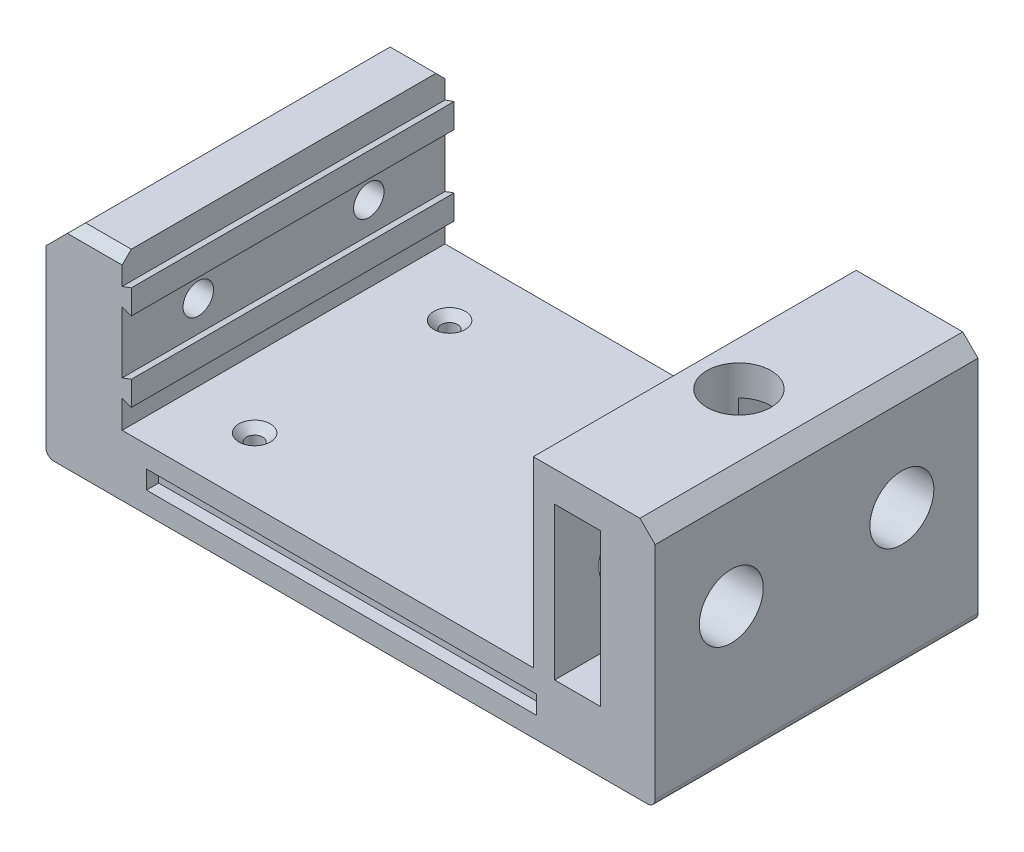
SolidWorks part; units mm, degrees
ref_plane "Спереди" through (0, 0, 0) normal (0, 0, 1) x (1, 0, 0)
ref_plane "Сверху" through (0, 0, 0) normal (0, 1, 0) x (1, 0, 0)
ref_plane "Справа" through (0, 0, 0) normal (1, 0, 0) x (0, 0, -1)
sketch "Эскиз1" plane through (0, 0, 0) normal (0, 0, 1) x (1, 0, 0)
  line L0 (-67.5, 0) -> (67.5, 0)
  line L1 (-67.5, 0) -> (-67.5, 50)
  line L2 (67.5, 0) -> (67.5, 60)
  line L3 (-67.5, 50) -> (-82.5, 50)
  line L4 (-82.5, 50) -> (-92.5, 40)
  line L5 (-92.5, 40) -> (-92.5, -20)
  line L6 (-92.5, -20) -> (107.5, -20)
  line L7 (0, 0) -> (0, 62.9278) construction
  line L8 (67.5, 60) -> (107.5, 60)
  line L10 (107.5, 60) -> (107.5, -20)
  point P4 (0, 0)
  dimension "D1" = 50
  dimension "D2" = 135
  dimension "D3" = 25
  dimension "D4" = 45
  dimension "D5" = 15
  dimension "D6" = 20
  dimension "D7" = 40
  dimension "D8" = 60
  dimension "D9" = 200
extrude "Бобышка-Вытянуть1" add sketch "Эскиз1" along normal mid plane 106
sketch "Эскиз2" plane through (67.5, 0, 0) normal (-1, 0, 0) x (0, 0, 1)
  line L0 (0, 0) -> (0, 50) construction
  line L1 (53, 0) -> (-53, 0) construction
  line L3 (0, 25) -> (-28, 25) construction
  line L4 (53, 50) -> (-53, 50) construction
  circle A1 centre (-28, 25) radius 10.5
  circle A2 centre (28, 25) radius 10.5
  dimension "D1" = 21
  dimension "D2" = 56
extrude "Вырез-Вытянуть1" cut sketch "Эскиз2" against normal through all
sketch "Эскиз3" plane through (0, 0, 53) normal (0, 0, 1) x (1, 0, 0)
  line L0 (67.5, 60) -> (107.5, 60) construction
  line L1 (107.5, -20) -> (107.5, 60) construction
  line L2 (82, 50) -> (82, 0) construction
  line L3 (67.5, 0) -> (-67.5, 0) construction
  line L4 (-67.5, 50) -> (-82.5, 50) construction
  line L5 (74.5, 0) -> (89.5, 0)
  line L6 (74.5, 0) -> (74.5, 50)
  line L7 (74.5, 50) -> (89.5, 50)
  line L8 (89.5, 0) -> (89.5, 50)
  line L9 (74.5, 0) -> (89.5, 50) construction
  line L10 (74.5, 50) -> (89.5, 0) construction
  line L11 (67.5, 60) -> (67.5, 0) construction
  point P3 (82, 25)
  dimension "D1" = 15
  dimension "D2" = 50
  dimension "D3" = 7
extrude "Вырез-Вытянуть2" cut sketch "Эскиз3" against normal through all
sketch "Эскиз4" plane through (0, 60, 0) normal (0, 1, 0) x (1, 0, 0)
  line L0 (96.5, 0) -> (67.5, 0) construction
  line L2 (67.5, -53) -> (67.5, 53) construction
  line L3 (82, 0) -> (82, -53) construction
  line L4 (74.5, -53) -> (89.5, -53) construction
  circle A0 centre (82, 0) radius 10.5
  dimension "D1" = 21
extrude "Вырез-Вытянуть3" cut sketch "Эскиз4" against normal up to surface (60 mm away)
sketch "Эскиз5" plane through (0, 0, 0) normal (0, 1, 0) x (1, 0, 0)
  circle A0 centre (82, 0) radius 10.5 construction
  circle A1 centre (82, 0) radius 10.5
extrude "Вырез-Вытянуть4" cut sketch "Эскиз5" against normal blind 8
sketch "Эскиз6" plane through (0, -8, 0) normal (0, 1, 0) x (1, 0, 0)
  circle A0 centre (82, 0) radius 7
  dimension "D1" = 14
extrude "Вырез-Вытянуть5" cut sketch "Эскиз6" against normal through all
sketch "Эскиз7" plane through (0, -20, 0) normal (0, -1, 0) x (1, 0, 0)
  circle A0 centre (82, 0) radius 13.5
  dimension "D1" = 27
extrude "Вырез-Вытянуть6" cut sketch "Эскиз7" against normal offset from surface (7 mm away) 5
sketch "Эскиз8" plane through (-67.5, 0, 0) normal (1, 0, 0) x (0, 0, -1)
  circle A0 centre (-28, 25) radius 5
  circle A1 centre (28, 25) radius 5
  dimension "D1" = 10
extrude "Вырез-Вытянуть7" cut sketch "Эскиз8" against normal through all
sketch "Эскиз9" plane through (0, 0, 53) normal (0, 0, 1) x (1, 0, 0)
  line L0 (-59.5, 0) -> (-59.5, -10) construction
  line L1 (-59.5, -10) -> (68.5, -10) construction
  line L2 (68.5, -10) -> (68.5, 0) construction
  line L3 (-59.5, -10) -> (-59.5, -20) construction
  line L4 (-92.5, -20) -> (107.5, -20) construction
  line L5 (67.5, 60) -> (67.5, 0) construction
  line L6 (-59.5, -13) -> (68.5, -13)
  line L7 (-59.5, -13) -> (-59.5, -7)
  line L8 (-59.5, -7) -> (68.5, -7)
  line L9 (68.5, -13) -> (68.5, -7)
  line L10 (-59.5, -13) -> (68.5, -7) construction
  line L11 (-59.5, -7) -> (68.5, -13) construction
  line L12 (-67.5, 0) -> (-67.5, 50) construction
  line L13 (67.5, 0) -> (-67.5, 0) construction
  point P6 (4.5, -10)
  dimension "D1" = 6
  dimension "D2" = 1
  dimension "D3" = 8
extrude "Вырез-Вытянуть8" cut sketch "Эскиз9" against normal blind 4
mirror "Зеркальное отражение1" about plane through (0, 0, 0) normal (0, 0, 1) of "Вырез-Вытянуть8"
sketch "Эскиз11" plane through (0, 0, 53) normal (0, 0, 1) x (1, 0, 0)
  line L0 (-67.5, 40.9081) -> (-64.5, 42)
  line L2 (-67.5, 0) -> (-67.5, 50) construction
  line L3 (-64.5, 42) -> (-64.5, 34)
  line L4 (-64.5, 38) -> (-56.0134, 38) construction
  line L5 (-67.5, 35.0919) -> (-64.5, 34)
  line L6 (-67.5, 40.9081) -> (-67.5, 35.0919)
  line L7 (-67.5, 25) -> (-50.1861, 25) construction
  line L8 (-64.5, 8) -> (-64.5, 16)
  line L9 (-67.5, 9.0919) -> (-64.5, 8)
  line L10 (-67.5, 9.0919) -> (-67.5, 14.9081)
  line L11 (-67.5, 14.9081) -> (-64.5, 16)
  line L12 (-64.5, 12) -> (-50.1861, 12) construction
  dimension "D1" = 40
  dimension "D2" = 3
  dimension "D3" = 8
  dimension "D4" = 26
extrude "Бобышка-Вытянуть2" add sketch "Эскиз11" against normal up to surface (106 mm away)
chamfer "Фаска1" distance 5 angle 45 1 edges at (107.5, 60, 0)
chamfer "Фаска2" distance 3 angle 45 2 edges at (-75, 50, -53) (-75, 50, 53)
fillet "Скругление1" radius 2.5 2 edges at (107.5, -20, 0) (-92.5, -20, 0)
sketch "Эскиз13" plane through (0, 0, 0) normal (0, 1, 0) x (1, 0, 0)
  line L1 (-45, -32) -> (45, -32) construction
  line L2 (-45, -32) -> (-45, 32) construction
  line L3 (-45, 32) -> (45, 32) construction
  line L4 (45, -32) -> (45, 32) construction
  line L5 (-45, -32) -> (45, 32) construction
  line L6 (-45, 32) -> (45, -32) construction
  circle A0 centre (-45, 32) radius 2.675
  circle A1 centre (45, 32) radius 2.675 construction
  circle A2 centre (-45, -32) radius 2.675
  circle A3 centre (45, -32) radius 2.675 construction
  circle A4 centre (45, 0) radius 2.675
  point P0 (0, 0)
  dimension "D3" = 5.35
  dimension "D1" = 90
  dimension "D2" = 64
extrude "Вырез-Вытянуть11" cut sketch "Эскиз13" against normal through all
chamfer "Фаска3" distance 2.5 angle 45 3 edges at (-47.675, 0, 32) (-47.675, 0, -32) (42.325, 0, 0)
chamfer "Фаска4" distance 2 angle 45 3 edges at (42.325, -20, 0) (-47.675, -20, -32) (-47.675, -20, 32)
